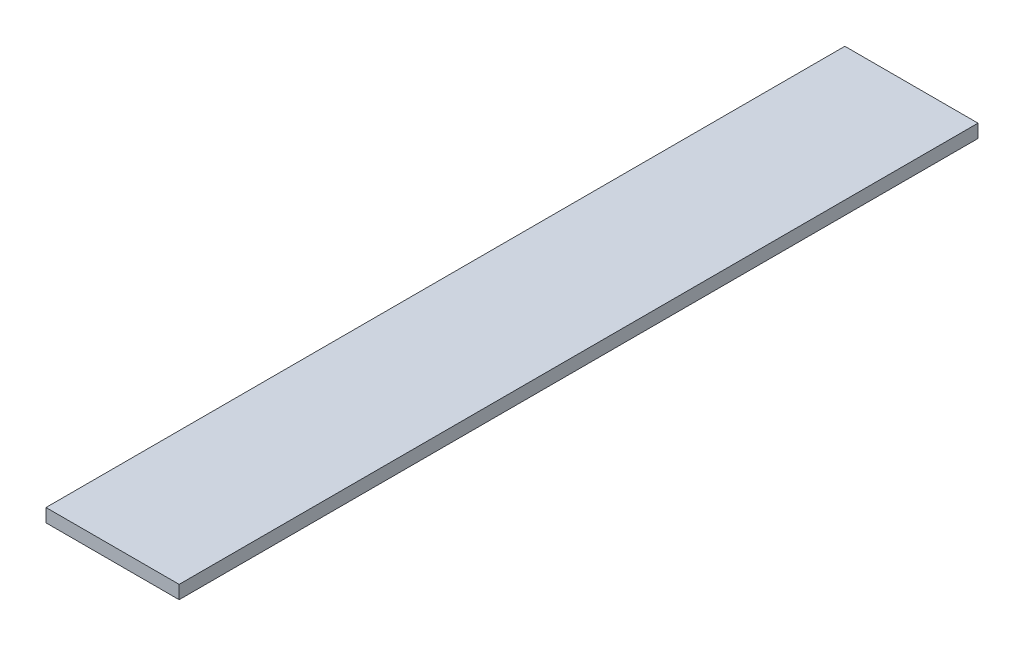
SolidWorks part; units mm, degrees
ref_plane "Face" through (0, 0, 0) normal (0, 0, 1) x (1, 0, 0)
ref_plane "Dessus" through (0, 0, 0) normal (0, 1, 0) x (1, 0, 0)
ref_plane "Droite" through (0, 0, 0) normal (1, 0, 0) x (0, 0, -1)
sketch "Esquisse1" plane through (0, 0, 0) normal (0, 0, 1) x (1, 0, 0)
  line L1 (0, 0) -> (50, 0)
  line L2 (0, 0) -> (0, -5)
  line L3 (0, -5) -> (50, -5)
  line L4 (50, 0) -> (50, -5)
  dimension "D1" = 50
  dimension "D2" = 5
extrude "Base-Extrusion" add sketch "Esquisse1" along normal blind 300
